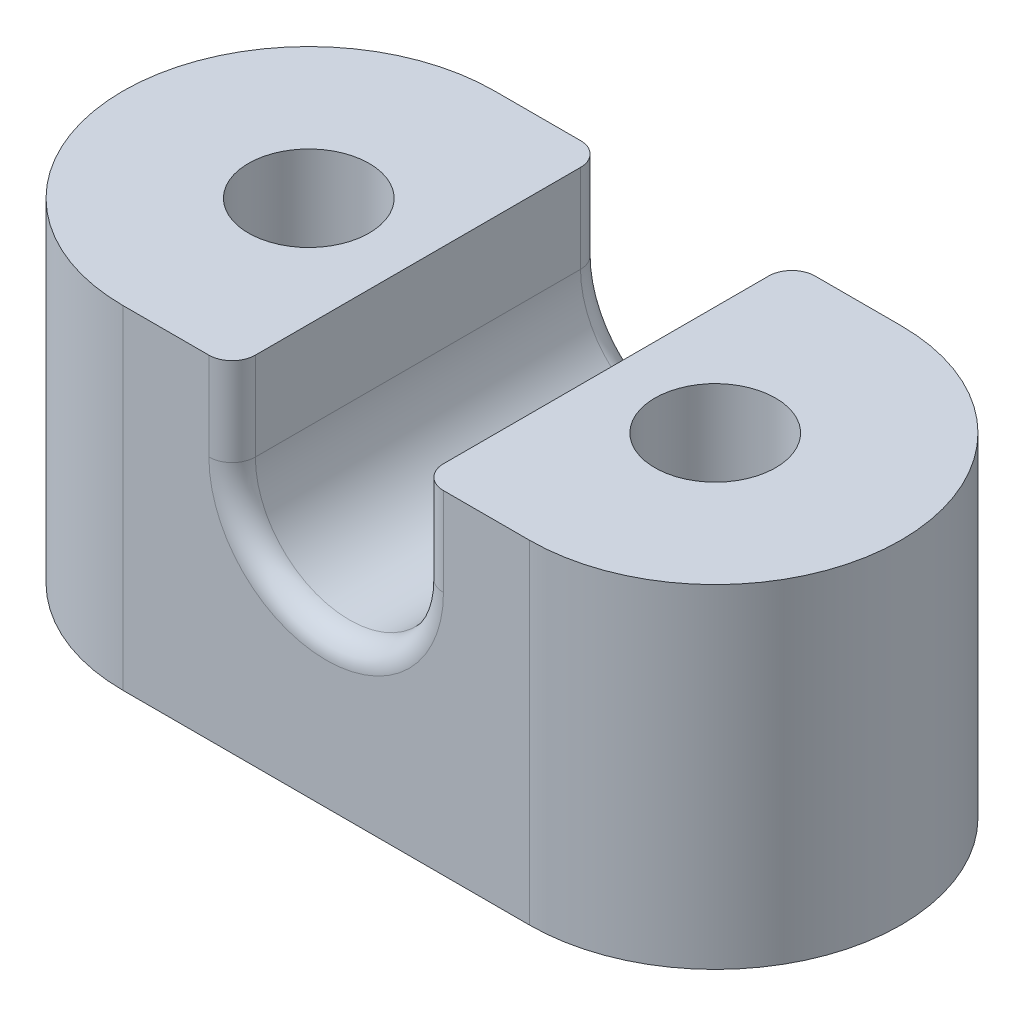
SolidWorks part; units mm, degrees
ref_plane "Plan de face" through (0, 0, 0) normal (0, 0, 1) x (1, 0, 0)
ref_plane "Plan de dessus" through (0, 0, 0) normal (0, 1, 0) x (1, 0, 0)
ref_plane "Plan de droite" through (0, 0, 0) normal (1, 0, 0) x (0, 0, -1)
sketch "Esquisse2" plane through (0, 0, 0) normal (0, 1, 0) x (1, 0, 0)
  line L0 (-61.2681, 0) -> (-43.7681, 0) construction
  line L1 (-61.2681, 8) -> (-43.7681, 8)
  line L2 (-61.2681, -8) -> (-43.7681, -8)
  arc A0 (-61.2681, 8) -> (-61.2681, -8) centre (-61.2681, 0) ccw
  arc A1 (-43.7681, -8) -> (-43.7681, 8) centre (-43.7681, 0) ccw
  point P3 (-52.5181, 0)
  dimension "D1" = 16
  dimension "D2" = 17.5
extrude "Boss.-Extru.1" add sketch "Esquisse2" along normal blind 14.35
sketch "Esquisse3" plane through (0, 0, 0) normal (0, -1, 0) x (1, 0, 0)
  circle A0 centre (-61.2681, 0) radius 2.6
  circle A1 centre (-43.7681, 0) radius 2.6
  dimension "D1" = 5.2
  dimension "D2" = 5.2
extrude "Enlèv. mat.-Extru.1" cut sketch "Esquisse3" against normal blind 14.35
sketch "Esquisse4" plane through (0, 0, 0) normal (0, -1, 0) x (1, 0, 0)
  circle A0 centre (-43.7681, 0) radius 4.25
  circle A1 centre (-61.2681, 0) radius 4.25
  dimension "D1" = 8.5
  dimension "D2" = 8.5
extrude "Enlèv. mat.-Extru.2" cut sketch "Esquisse4" against normal blind 4
sketch "Esquisse5" plane through (0, 0, -8) normal (0, 0, -1) x (-1, 0, 0)
  line L0 (52.5181, 10.55) -> (52.5181, 22.4871) construction
  line L1 (48.4681, 10.55) -> (48.4681, 22.4871)
  line L2 (56.5681, 10.55) -> (56.5681, 22.4871)
  line L3 (43.7681, 14.35) -> (61.2681, 14.35) construction
  arc A0 (48.4681, 10.55) -> (56.5681, 10.55) centre (52.5181, 10.55) ccw
  arc A1 (56.5681, 22.4871) -> (48.4681, 22.4871) centre (52.5181, 22.4871) ccw
  point P2 (52.5181, 16.5186)
  dimension "D2" = 4.05
  dimension "D1" = 3.8
extrude "Enlèv. mat.-Extru.3" cut sketch "Esquisse5" against normal through all
fillet "Congé1" radius 1 3 edges at (-48.4681, 12.45, -8) (-56.5681, 12.45, -8) (-52.5181, 6.5, -8)
fillet "Congé2" radius 1 3 edges at (-48.4681, 12.45, 8) (-52.5181, 6.5, 8) (-56.5681, 12.45, 8)
